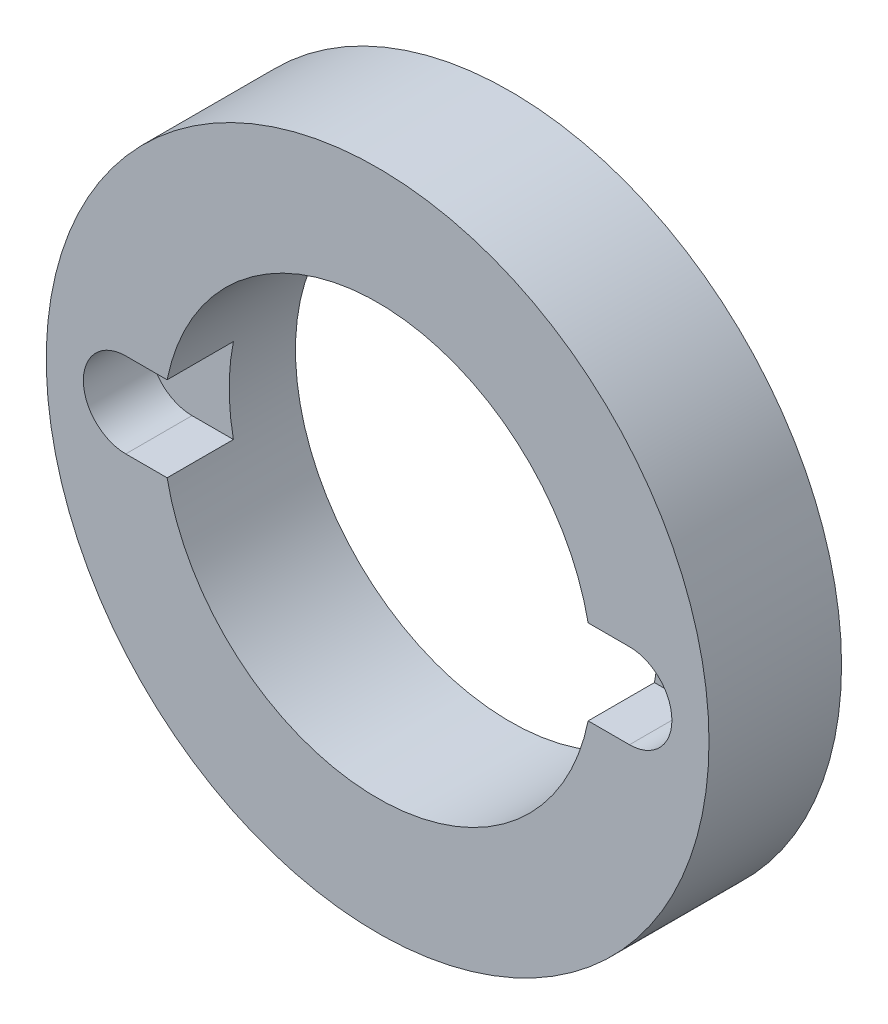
SolidWorks part; units mm, degrees
ref_plane "Plan de face" through (0, 0, 0) normal (0, 0, 1) x (1, 0, 0)
ref_plane "Plan de dessus" through (0, 0, 0) normal (0, 1, 0) x (1, 0, 0)
ref_plane "Plan de droite" through (0, 0, 0) normal (1, 0, 0) x (0, 0, -1)
sketch "Esquisse1" plane through (0, 0, 0) normal (0, 0, 1) x (1, 0, 0)
  circle A0 centre (0, 0) radius 12.5
  dimension "D1" = 25
extrude "Extrusion1" add sketch "Esquisse1" along normal blind 5
sketch "Esquisse2" plane through (0, 0, 5) normal (0, 0, 1) x (1, 0, 0)
  circle A0 centre (0, 0) radius 8.1
  dimension "D1" = 16.2
extrude "Enlèv. mat.-Extru.1" cut sketch "Esquisse2" against normal blind 5
sketch "Esquisse3" plane through (0, 0, 5) normal (0, 0, 1) x (1, 0, 0)
  line L0 (-15.8949, 0) -> (15.8193, 0) construction
  line L1 (0, 14.0049) -> (0, -14.7231) construction
  line L2 (-9.5, 1.6) -> (9.5, 1.6)
  line L3 (9.5, -1.6) -> (-9.5, -1.6)
  arc A0 (9.5, -1.6) -> (9.5, 1.6) centre (9.5, 0) ccw
  arc A1 (-9.5, -1.6) -> (-9.5, 1.6) centre (-9.5, 0) cw
  dimension "D1" = 3.2
  dimension "D2" = 9.5
  dimension "D3" = 9.5
extrude "Enlèv. mat.-Extru.2" cut sketch "Esquisse3" against normal blind 2.5
